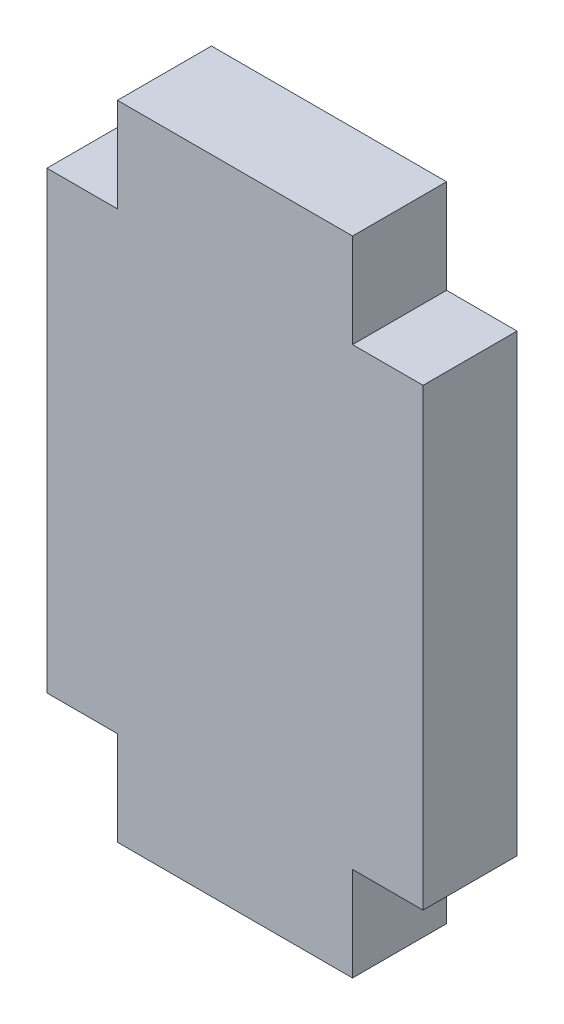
SolidWorks part; units mm, degrees
ref_plane "Front Plane" through (0, 0, 0) normal (0, 0, 1) x (1, 0, 0)
ref_plane "Top Plane" through (0, 0, 0) normal (0, 1, 0) x (1, 0, 0)
ref_plane "Right Plane" through (0, 0, 0) normal (1, 0, 0) x (0, 0, -1)
sketch "Sketch1" plane through (0, 0, 0) normal (0, 0, 1) x (1, 0, 0)
  line L0 (-17.482, 17.5) -> (-17.482, 14.5)
  line L1 (-17.482, 14.5) -> (-19.732, 14.5)
  line L2 (-19.732, 14.5) -> (-19.732, 0)
  line L3 (-19.732, 0) -> (-17.482, 0)
  line L4 (-17.482, 0) -> (-17.482, -3)
  line L5 (-17.482, -3) -> (-9.982, -3)
  line L6 (-17.482, 17.5) -> (-9.982, 17.5)
  line L9 (-13.732, 17.5) -> (-13.732, -3) construction
  line L10 (-13.732, 17.5) -> (-13.732, 17.9243) construction
  line L11 (-17.482, 17.5) -> (-9.982, 17.5) construction
  line L12 (-17.482, -3) -> (-9.982, -3) construction
  line L13 (-9.982, 0) -> (-9.982, -3)
  line L14 (-7.732, 0) -> (-9.982, 0)
  line L15 (-7.732, 14.5) -> (-7.732, 0)
  line L16 (-9.982, 14.5) -> (-7.732, 14.5)
  line L17 (-9.982, 17.5) -> (-9.982, 14.5)
  dimension "D1" = 6
extrude "Boss-Extrude1" add sketch "Sketch1" along normal up to surface (3 mm away)
